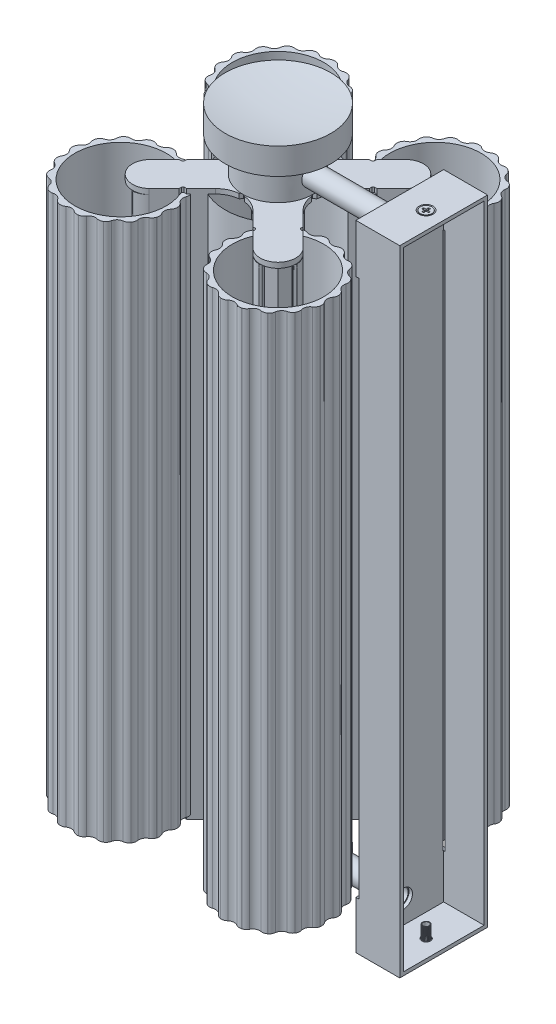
SolidWorks part; units mm, degrees
ref_plane "Alzado" through (0, 0, 0) normal (0, 0, 1) x (1, 0, 0)
ref_plane "Planta" through (0, 0, 0) normal (0, 1, 0) x (1, 0, 0)
ref_plane "Vista lateral" through (0, 0, 0) normal (1, 0, 0) x (0, 0, -1)
imported_body "Drawing1 (1).iges-1/Drawing1 (1)3.iges-1-surface1"
imported_body "Drawing1 (1).iges-1/Drawing1 (1)15.iges-1-solid1"
imported_body "Drawing1 (1).iges-1/Drawing1 (1)16.iges-1-solid1"
imported_body "Drawing1 (1).iges-1/Drawing1 (1)17.iges-1-solid1"
ref_plane "Plano1" through (0, 165, 0) normal (0, 1, 0) x (1, 0, 0)
sketch "Croquis1" plane through (0, 165, 0) normal (0, 1, 0) x (1, 0, 0)
  line L0 (4197.6681, 5955.3875) -> (4110.694, 5868.4134) construction
  arc A19 (4198.0217, 5941.4575) -> (4183.7381, 5955.7411) centre (4190.5171, 5948.2365) ccw construction
  arc A20 (4110.3404, 5882.3434) -> (4124.624, 5868.0598) centre (4117.845, 5875.5644) ccw construction
  circle A21 centre (4198.9855, 5956.7049) radius 30
  circle A22 centre (4198.9855, 5956.7049) radius 26
  circle A23 centre (4154.181, 5911.9005) radius 30.0112
  circle A24 centre (4198.9855, 5867.096) radius 30
  circle A25 centre (4198.9855, 5867.096) radius 26
  circle A26 centre (4109.3766, 5867.096) radius 30
  circle A27 centre (4109.3766, 5867.096) radius 26
  circle A28 centre (4109.3766, 5956.7049) radius 30
  circle A29 centre (4109.3766, 5956.7049) radius 26
  point P27 (4154.181, 5911.9005)
  dimension "D1" = 60
  dimension "D2" = 52
extrude "Saliente-Extruir1" add sketch "Croquis1" along normal blind 306 separate body
sketch "Croquis2" plane through (0, 471, 0) normal (0, 1, 0) x (1, 0, 0)
  circle A1 centre (4210.5452, 5986.544) radius 4
  circle A3 centre (4198.9855, 5956.7049) radius 32 construction
  circle A5 centre (4198.9855, 5988.7049) radius 4
  circle A7 centre (4220.5438, 5980.3532) radius 4
  circle A9 centre (4227.6307, 5970.9685) radius 4
  circle A11 centre (4230.849, 5959.6575) radius 4
  circle A13 centre (4229.7639, 5947.9477) radius 4
  circle A15 centre (4224.5221, 5937.4206) radius 4
  circle A17 centre (4215.8313, 5929.498) radius 4
  circle A19 centre (4204.8655, 5925.2498) radius 4
  circle A21 centre (4193.1055, 5925.2498) radius 4
  circle A27 centre (4168.2071, 5947.9477) radius 4
  circle A29 centre (4167.122, 5959.6575) radius 4
  circle A31 centre (4170.3403, 5970.9685) radius 4
  circle A33 centre (4177.4272, 5980.3532) radius 4
  circle A35 centre (4187.4258, 5986.544) radius 4
  circle A37 centre (4154.1945, 5911.8988) radius 30
  circle A39 centre (4190.2433, 5897.8862) radius 4
  circle A41 centre (4201.9531, 5898.9713) radius 4
  circle A43 centre (4213.2642, 5895.7531) radius 4
  circle A45 centre (4222.6488, 5888.6661) radius 4
  circle A47 centre (4228.8397, 5878.6676) radius 4
  circle A49 centre (4231.0006, 5867.1078) radius 4
  circle A51 centre (4228.8397, 5855.5481) radius 4
  circle A53 centre (4222.6488, 5845.5496) radius 4
  circle A55 centre (4213.2642, 5838.4626) radius 4
  circle A57 centre (4201.9531, 5835.2443) radius 4
  circle A59 centre (4190.2433, 5836.3294) radius 4
  circle A61 centre (4179.7162, 5841.5713) radius 4
  circle A76 centre (5911.8988, -4154.1945) radius 30 construction
  circle A77 centre (-4154.1945, -5911.8988) radius 30 construction
  circle A78 centre (-5911.8988, 4154.1945) radius 30 construction
  circle A79 centre (4173.4489, 5937.4206) radius 4
  circle A80 centre (4182.1397, 5929.498) radius 4
  circle A81 centre (4171.7936, 5850.262) radius 4
  circle A82 centre (4167.5454, 5861.2278) radius 4
  circle A83 centre (4167.5454, 5872.9878) radius 4
  circle A84 centre (4140.1819, 5875.85) radius 4
  circle A85 centre (4141.267, 5864.1402) radius 4
  circle A86 centre (4138.0487, 5852.8291) radius 4
  circle A87 centre (4130.9617, 5843.4445) radius 4
  circle A88 centre (4120.9632, 5837.2537) radius 4
  circle A89 centre (4109.4035, 5835.0928) radius 4
  circle A90 centre (4097.8437, 5837.2537) radius 4
  circle A91 centre (4087.8452, 5843.4445) radius 4
  circle A92 centre (4080.7582, 5852.8291) radius 4
  circle A93 centre (4077.54, 5864.1402) radius 4
  circle A94 centre (4078.625, 5875.85) radius 4
  circle A95 centre (4083.8669, 5886.3771) radius 4
  circle A96 centre (4092.5576, 5894.2997) radius 4
  circle A97 centre (4103.5235, 5898.5479) radius 4
  circle A98 centre (4115.2834, 5898.5479) radius 4
  circle A99 centre (4118.1456, 5925.9114) radius 4
  circle A100 centre (4106.4358, 5924.8264) radius 4
  circle A101 centre (4095.1248, 5928.0446) radius 4
  circle A102 centre (4085.7401, 5935.1316) radius 4
  circle A103 centre (4079.5493, 5945.1301) radius 4
  circle A104 centre (4077.3884, 5956.6899) radius 4
  circle A105 centre (4079.5493, 5968.2496) radius 4
  circle A106 centre (4085.7401, 5978.2481) radius 4
  circle A107 centre (4095.1248, 5985.3351) radius 4
  circle A108 centre (4106.4358, 5988.5534) radius 4
  circle A109 centre (4118.1456, 5987.4683) radius 4
  circle A110 centre (4128.6727, 5982.2264) radius 4
  circle A111 centre (4136.5954, 5973.5357) radius 4
  circle A112 centre (4140.8435, 5962.5698) radius 4
  circle A113 centre (4140.8435, 5950.8099) radius 4
  point P38 (4198.9855, 5956.7049)
  point P49 (0, 0)
  point P159 (4154.1945, 5911.8988)
  dimension "D1" = 64
  dimension "D2" = 17
extrude "Cortar-Extruir1" cut sketch "Croquis2" against normal blind 306
ref_plane "Plano2" through (0, 460, 0) normal (0, 1, 0) x (1, 0, 0)
ref_plane "Plano3" through (0, 175, 0) normal (0, 1, 0) x (1, 0, 0)
fillet "Redondeo1" radius 4 30 edges at (4139.2953, 318, -5954.4981) (4138.0652, 318, -5947.9322) (4138.0723, 318, -5965.4544) (4139.2976, 318, -5958.8807) (4132.9726, 318, -5975.2314) (4136.4937, 318, -5969.537) (4124.6825, 318, -5982.5066) (4130.0298, 318, -5978.4637) (4114.3217, 318, -5986.2945) (4120.776, 318, -5984.4548) (4103.2912, 318, -5986.0812) (4109.9799, 318, -5986.6989) (4093.0837, 318, -5981.895) (4099.0999, 318, -5984.8899) (4120.7524, 318, -5928.9454) (4114.3316, 318, -5927.117) (4109.9642, 318, -5926.7107) (4103.3117, 318, -5927.3244) (4099.0963, 318, -5928.5213) (4093.1081, 318, -5931.499) (4089.6138, 318, -5934.1343) (4085.0998, 318, -5939.08) (4085.0803, 318, -5974.3029) (4089.6074, 318, -5979.2699) (4080.3626, 318, -5964.3332) (4082.7874, 318, -5970.5979) (4079.5665, 318, -5953.3349) (4079.5633, 318, -5960.0469) (4082.7965, 318, -5942.7944) (4080.371, 318, -5949.0448)
fillet "Redondeo2" radius 4 29 edges at (4169.3946, 318, -5951.7674) (4168.9912, 318, -5956.1211) (4169.6092, 318, -5962.7902) (4170.8057, 318, -5966.9957) (4173.7912, 318, -5972.9913) (4176.4261, 318, -5976.4805) (4181.3758, 318, -5980.9927) (4185.0933, 318, -5983.2945) (4191.3387, 318, -5985.714) (4195.6366, 318, -5986.5174) (4202.3344, 318, -5986.5174) (4196.7993, 318, -5926.7847) (4190.2156, 318, -5928.0154) (4207.7554, 318, -5928.0154) (4201.1717, 318, -5926.7847) (4217.527, 318, -5933.1208) (4211.8325, 318, -5929.5949) (4224.7945, 318, -5941.4113) (4220.7583, 318, -5936.0664) (4228.5764, 318, -5951.7674) (4226.7435, 318, -5945.3253) (4228.3618, 318, -5962.7902) (4228.9798, 318, -5956.1211) (4206.6323, 318, -5985.714) (4212.8777, 318, -5983.2945) (4216.5952, 318, -5980.9927) (4221.5449, 318, -5976.4805) (4224.1798, 318, -5972.9913) (4227.1653, 318, -5966.9957)
fillet "Redondeo3" radius 4 30 edges at (4080.0046, 318, -5860.9897) (4079.3825, 318, -5867.6906) (4084.1973, 318, -5850.7864) (4081.1969, 318, -5856.805) (4091.7914, 318, -5842.7904) (4086.8245, 318, -5847.3121) (4101.7575, 318, -5838.0796) (4095.5025, 318, -5840.4969) (4112.7485, 318, -5837.2861) (4106.0547, 318, -5837.2805) (4123.2817, 318, -5840.5132) (4117.0526, 318, -5838.0946) (4131.9386, 318, -5847.3234) (4127.0099, 318, -5842.8253) (4137.5539, 318, -5856.7984) (4134.5841, 318, -5850.83) (4139.3712, 318, -5867.6624) (4138.7562, 318, -5861.0264) (4137.1441, 318, -5878.4523) (4138.9665, 318, -5872.0391) (4079.7837, 318, -5872.0215) (4081.6263, 318, -5878.4943) (4083.5668, 318, -5882.3884) (4087.6224, 318, -5887.7541) (4090.8426, 318, -5890.6861) (4096.5568, 318, -5894.2189) (4100.6251, 318, -5895.7912) (4107.2195, 318, -5897.0183) (4111.5891, 318, -5897.0143) (4118.1696, 318, -5895.7784)
fillet "Redondeo4" radius 4 30 edges at (4187.6254, 318, -5894.8619) (4194.0599, 318, -5896.6889) (4169.0657, 318, -5869.288) (4170.3022, 318, -5875.8861) (4194.0677, 318, -5837.5018) (4187.6069, 318, -5839.3376) (4183.7055, 318, -5841.2789) (4178.3421, 318, -5845.3279) (4175.4073, 318, -5848.5469) (4171.8696, 318, -5854.2613) (4170.2966, 318, -5858.3242) (4169.0639, 318, -5864.9284) (4205.0918, 318, -5837.724) (4198.4104, 318, -5837.1015) (4215.2886, 318, -5841.9125) (4209.2906, 318, -5838.9214) (4223.2826, 318, -5849.499) (4218.7759, 318, -5844.5496) (4227.997, 318, -5859.4583) (4225.585, 318, -5853.2228) (4228.7978, 318, -5870.4467) (4228.8003, 318, -5863.7674) (4225.5779, 318, -5880.9829) (4227.9904, 318, -5874.7588) (4218.7709, 318, -5889.6468) (4223.2672, 318, -5884.7142) (4209.2935, 318, -5895.2695) (4215.2694, 318, -5892.2919) (4198.4228, 318, -5897.0907) (4205.0756, 318, -5896.4713)
